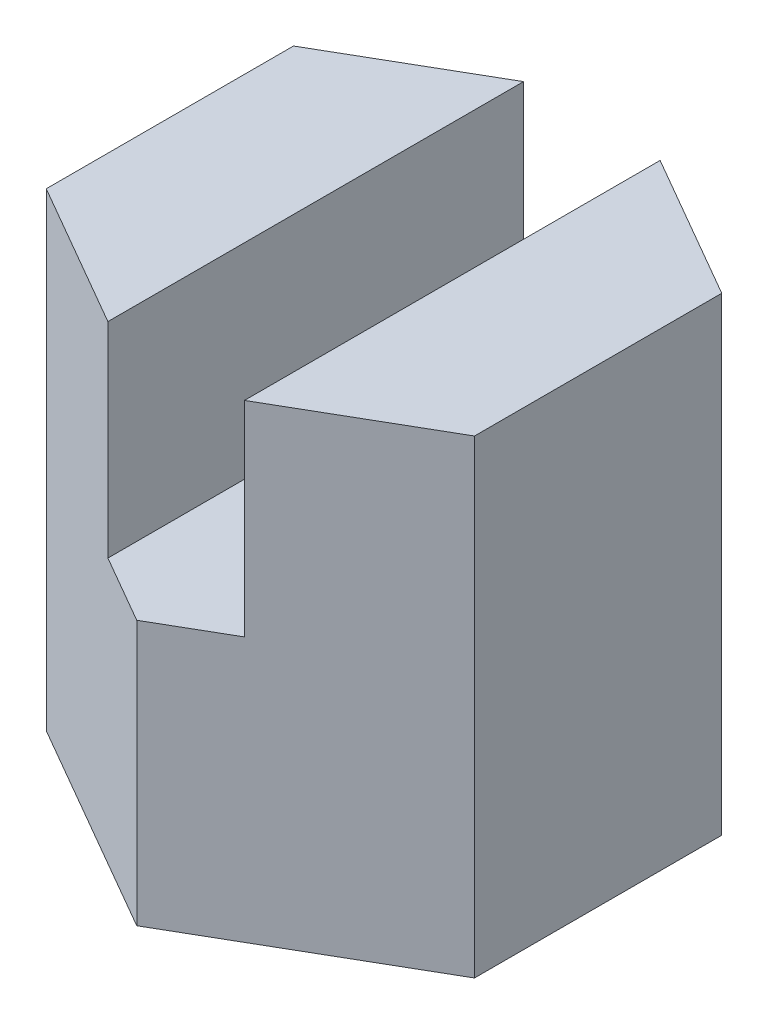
SolidWorks part; units mm, degrees
ref_plane "前视基准面" through (0, 0, 0) normal (0, 0, 1) x (1, 0, 0)
ref_plane "上视基准面" through (0, 0, 0) normal (0, 1, 0) x (1, 0, 0)
ref_plane "右视基准面" through (0, 0, 0) normal (1, 0, 0) x (0, 0, -1)
sketch "草图1" plane through (0, 0, 0) normal (0, 1, 0) x (1, 0, 0)
  line L1 (0, 57.9424) -> (-50.1796, 28.9712)
  line L2 (-50.1796, 28.9712) -> (-50.1796, -28.9712)
  line L3 (-50.1796, -28.9712) -> (0, -57.9424)
  line L4 (0, -57.9424) -> (50.1796, -28.9712)
  line L5 (50.1796, -28.9712) -> (50.1796, 28.9712)
  line L6 (50.1796, 28.9712) -> (0, 57.9424)
  circle A0 centre (0, 0) radius 50.1796 construction
extrude "凸台-拉伸1" add sketch "草图1" along normal blind 110
sketch "草图3" plane through (0, 0, 0) normal (0, 0, 1) x (1, 0, 0)
  line L0 (0, 113.5036) -> (0, 43.2274)
  line L1 (0, 110) -> (0, 0) construction
  line L2 (-16, 110) -> (-16, 62)
  line L3 (-50.1796, 110) -> (0, 110) construction
  line L4 (-16, 62) -> (16, 62)
  line L5 (-16, 110) -> (16, 110)
  line L6 (16, 110) -> (16, 62)
  point P12 (0, 62)
  point P13 (0, 110)
  dimension "D1" = 16
  dimension "D2" = 48
extrude "切除-拉伸1" cut sketch "草图3" against normal through all and the other way through all contours L2 L4 L6 L5
